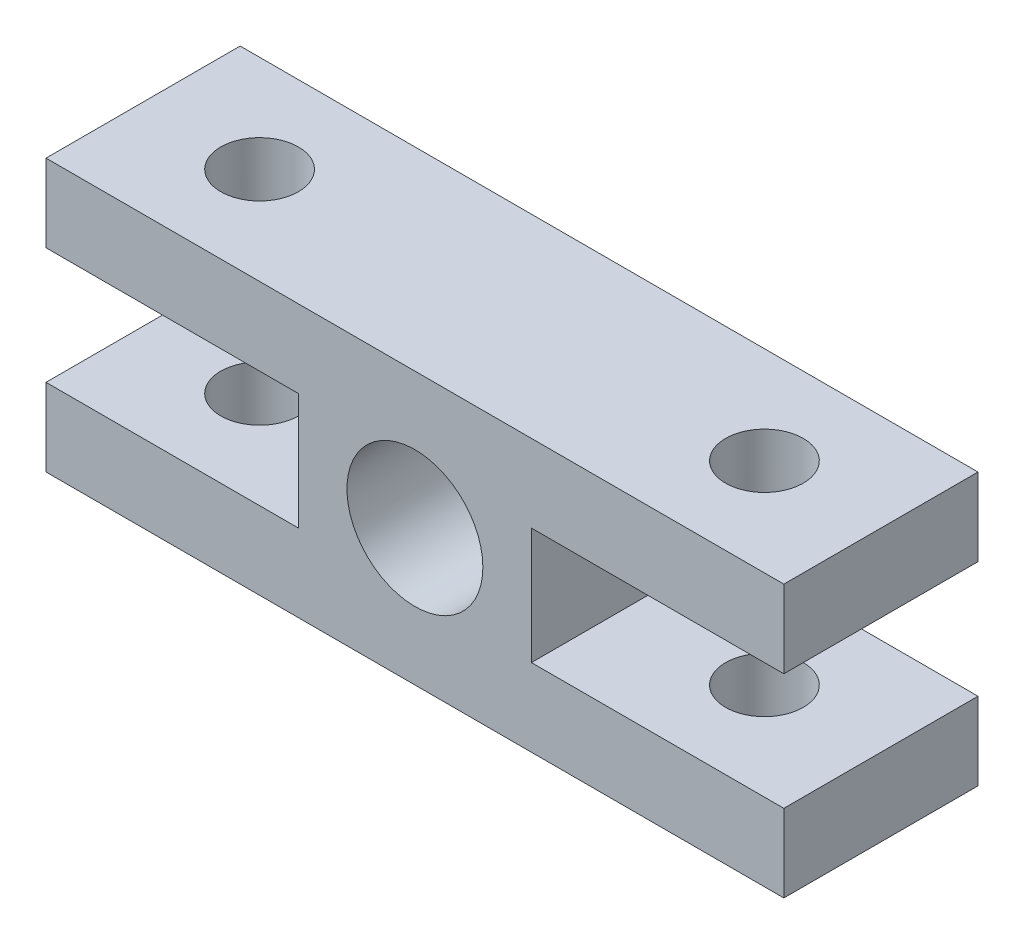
SolidWorks part; units mm, degrees
ref_plane "Face" through (0, 0, 0) normal (0, 0, 1) x (1, 0, 0)
ref_plane "Dessus" through (0, 0, 0) normal (0, 1, 0) x (1, 0, 0)
ref_plane "Droite" through (0, 0, 0) normal (1, 0, 0) x (0, 0, -1)
sketch "Esquisse1" plane through (0, 0, 0) normal (0, 0, 1) x (1, 0, 0)
  line L0 (12, -6) -> (38, -6)
  line L1 (-38, 14) -> (38, 14)
  line L2 (-38, 14) -> (-38, 6)
  line L3 (-38, 6) -> (-12, 6)
  line L4 (38, 14) -> (38, 6)
  line L5 (-38, -6) -> (-12, -6)
  line L6 (-38, -6) -> (-38, -14)
  line L7 (-38, -14) -> (38, -14)
  line L8 (38, -6) -> (38, -14)
  line L10 (-12, 6) -> (-12, -6)
  line L11 (12, 6) -> (38, 6)
  line L12 (12, 6) -> (12, -6)
  dimension "D1" = 8
  dimension "D2" = 8
  dimension "D3" = 6
  dimension "D4" = 6
  dimension "D5" = 12
  dimension "D6" = 12
  dimension "D7" = 26
  dimension "D8" = 26
  dimension "D9" = 26
  dimension "D10" = 26
extrude "Base-Extrusion" add sketch "Esquisse1" along normal blind 20
sketch "Esquisse2" plane through (0, 0, 20) normal (0, 0, 1) x (1, 0, 0)
  circle A0 centre (0, 0) radius 7
  dimension "D1" = 14
extrude "Enlèv. mat.-Extru.1" cut sketch "Esquisse2" against normal blind 20
sketch "Esquisse3" plane through (0, -14, 0) normal (0, -1, 0) x (1, 0, 0)
  line L0 (-38, 20) -> (38, 20) construction
  line L1 (38, 20) -> (38, 0) construction
  circle A0 centre (26, 10) radius 4
  dimension "D1" = 8
  dimension "D2" = 10
  dimension "D3" = 12
extrude "Enlèv. mat.-Extru.2" cut sketch "Esquisse3" against normal blind 33.736
mirror "Symétrie1" about plane through (0, 0, 0) normal (1, 0, 0) of "Enlèv. mat.-Extru.2"
